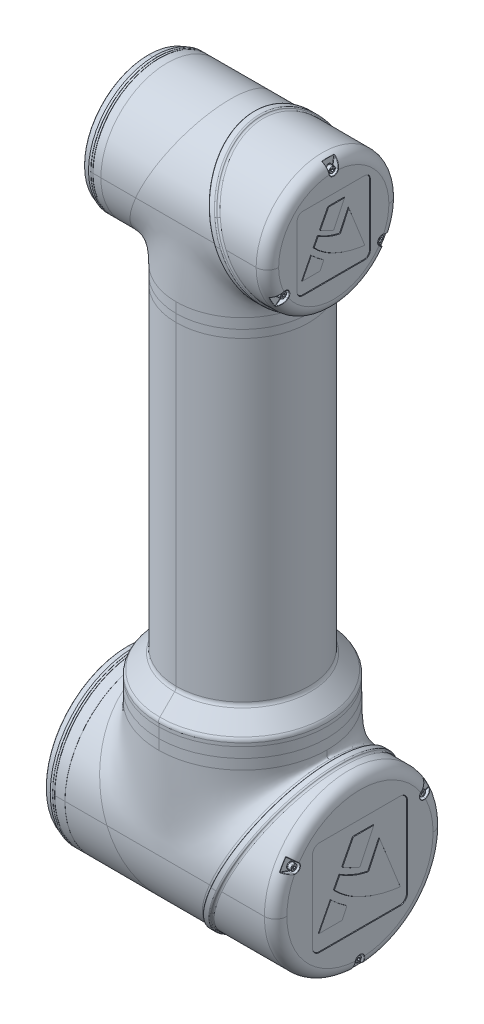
SolidWorks part; units mm, degrees
ref_plane "前视基准面" through (0, 0, 0) normal (0, 0, 1) x (1, 0, 0)
ref_plane "上视基准面" through (0, 0, 0) normal (0, 1, 0) x (1, 0, 0)
ref_plane "右视基准面" through (0, 0, 0) normal (1, 0, 0) x (0, 0, -1)
imported_body "输入1"
chamfer "倒角1" distance 0.5 angle 45
ref_plane "基准面1" through (264.1966, 0, 0) normal (-1, 0, 0) x (0, 0, 1)
ref_plane "基准面2" through (255.0366, 0, 0) normal (-1, 0, 0) x (0, 0, 1)
split "分割1" trim tools "基准面2", "基准面1" bodies to split 106 resulting bodies 107 108 130
delete or keep bodies "实体-删除/保留 1" type delete bodies bodies 107
move or copy body "实体-移动/复制1" bodies to move or copy 108 placed by mates yes
combine bodies "组合1" operation type add bodies to combine 130 109
ref_plane "基准面3" through (0, 297.9289, 0) normal (0, 1, 0) x (1, 0, 0)
ref_plane "基准面4" through (0, 294.9989, 0) normal (0, 1, 0) x (1, 0, 0)
ref_plane "基准面5" through (0, 285.9989, 0) normal (0, 1, 0) x (1, 0, 0)
ref_plane "基准面6" through (-0.0001, 746.5, -0.0001) normal (0, 1, 0) x (1, 0, 0)
ref_plane "基准面7" through (-0.0001, 737.5, -0.0001) normal (0, 1, 0) x (1, 0, 0)
ref_plane "基准面8" through (-0.0001, 730.5, -0.0001) normal (0, 1, 0) x (1, 0, 0)
ref_plane "基准面9" through (117, 0, 0) normal (-1, 0, 0) x (0, 0, 1)
ref_plane "基准面10" through (92, 0, 0) normal (-1, 0, 0) x (0, 0, 1)
ref_plane "基准面11" through (101, 0, 0) normal (1, 0, 0) x (0, 0, -1)
ref_plane "基准面12" through (126.327, -53.6226, 0) normal (-0.9205, 0.3907, 0) x (0, 0, 1)
split "分割2" trim tools "基准面12", "基准面10", "基准面11" bodies to split 113 resulting bodies 114 115 116 117 118
combine bodies "组合2" operation type add bodies to combine 117 118
split "分割3" trim tools "基准面4", "基准面5" bodies to split 119 resulting bodies 120 121 122
split "分割4" trim tools "基准面7", "基准面8" bodies to split 121 resulting bodies 123 124 125
ref_plane "基准面13" through (110, 0, 0) normal (-1, 0, 0) x (0, 0, 1)
ref_plane "基准面14" through (477.3349, 202.6166, 0) normal (-0.9205, -0.3907, 0) x (0, 0, 1)
split "分割5" trim tools "基准面14", "基准面13", "基准面9" bodies to split 124 resulting bodies 126 127 128 129
ref_plane "基准面15" through (0, 318.0711, 0) normal (0, 1, 0) x (1, 0, 0)
ref_plane "基准面16" through (0, 450.5711, 0) normal (0, 1, 0) x (1, 0, 0)
split "分割6" trim tools "基准面15", "基准面16" bodies to split 125 resulting bodies 131 132
move or copy body "实体-移动/复制2" bodies to move or copy 127 131 128 123 129 126 placed by mates yes
combine bodies "组合3" operation type add bodies to combine 134 132
